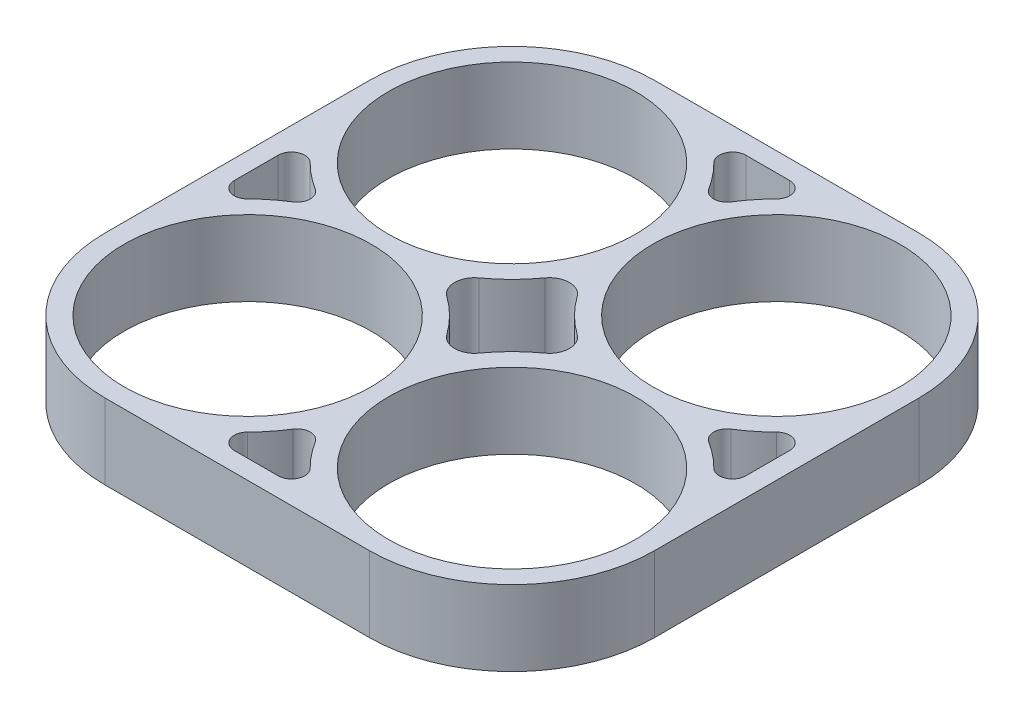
SolidWorks part; units mm, degrees
ref_plane "Ebene vorne" through (0, 0, 0) normal (0, 0, 1) x (1, 0, 0)
ref_plane "Ebene oben" through (0, 0, 0) normal (0, 1, 0) x (1, 0, 0)
ref_plane "Ebene rechts" through (0, 0, 0) normal (1, 0, 0) x (0, 0, -1)
sketch "Skizze1" plane through (0, 0, 0) normal (0, 1, 0) x (1, 0, 0)
  line L0 (-10, 20.8) -> (10, 20.8)
  line L1 (-20.8, 10) -> (-20.8, -10)
  line L2 (-10, -20.8) -> (10, -20.8)
  line L3 (20.8, -10) -> (20.8, 10)
  line L4 (0, -50) -> (0, 50) construction
  line L5 (-50, 0) -> (50, 0) construction
  line L6 (-19.35, 1.6623) -> (-19.35, -1.6623)
  line L7 (-1.6623, -19.35) -> (1.6623, -19.35)
  line L8 (-1.6623, 19.35) -> (1.6623, 19.35)
  line L9 (19.35, 1.6623) -> (19.35, -1.6623)
  circle A0 centre (-10, 10) radius 9.35
  circle A1 centre (10, 10) radius 9.35
  circle A2 centre (-10, -10) radius 9.35
  circle A3 centre (10, -10) radius 9.35
  arc A4 (-0.8475, 15.7333) -> (-2.3689, 17.6424) centre (-10, 10) ccw
  arc A5 (1.2195, 3.7117) -> (3.7117, 1.2195) centre (10, 10) ccw
  arc A6 (0.8475, -15.7333) -> (2.3689, -17.6424) centre (10, -10) ccw
  arc A7 (-1.2195, -3.7117) -> (-3.7117, -1.2195) centre (-10, -10) ccw
  arc A8 (15.7333, 0.8475) -> (17.6424, 2.3689) centre (10, 10) ccw
  arc A9 (-15.7333, -0.8475) -> (-17.6424, -2.3689) centre (-10, -10) ccw
  arc A10 (3.7117, -1.2195) -> (1.2195, -3.7117) centre (10, -10) ccw
  arc A11 (-3.7117, 1.2195) -> (-1.2195, 3.7117) centre (-10, 10) ccw
  arc A12 (-10, 20.8) -> (-20.8, 10) centre (-10, 10) ccw
  arc A13 (2.3689, 17.6424) -> (0.8475, 15.7333) centre (10, 10) ccw
  arc A14 (20.8, 10) -> (10, 20.8) centre (10, 10) ccw
  arc A15 (17.6424, -2.3689) -> (15.7333, -0.8475) centre (10, -10) ccw
  arc A16 (-20.8, -10) -> (-10, -20.8) centre (-10, -10) ccw
  arc A17 (-17.6424, 2.3689) -> (-15.7333, 0.8475) centre (-10, 10) ccw
  arc A18 (10, -20.8) -> (20.8, -10) centre (10, -10) ccw
  arc A19 (-2.3689, -17.6424) -> (-0.8475, -15.7333) centre (-10, -10) ccw
  arc A20 (-0.8475, 15.7333) -> (0.8475, 15.7333) centre (0, 16.2642) ccw
  arc A21 (2.3689, 17.6424) -> (1.6623, 19.35) centre (1.6623, 18.35) ccw
  arc A22 (-2.3689, 17.6424) -> (-1.6623, 19.35) centre (-1.6623, 18.35) cw
  arc A23 (15.7333, -0.8475) -> (15.7333, 0.8475) centre (16.2642, 0) cw
  arc A24 (17.6424, -2.3689) -> (19.35, -1.6623) centre (18.35, -1.6623) ccw
  arc A25 (19.35, 1.6623) -> (17.6424, 2.3689) centre (18.35, 1.6623) ccw
  arc A26 (-1.6623, -19.35) -> (-2.3689, -17.6424) centre (-1.6623, -18.35) cw
  arc A27 (1.6623, -19.35) -> (2.3689, -17.6424) centre (1.6623, -18.35) ccw
  arc A28 (0.8475, -15.7333) -> (-0.8475, -15.7333) centre (0, -16.2642) ccw
  arc A29 (-19.35, -1.6623) -> (-17.6424, -2.3689) centre (-18.35, -1.6623) ccw
  arc A30 (-15.7333, -0.8475) -> (-15.7333, 0.8475) centre (-16.2642, 0) ccw
  arc A31 (-17.6424, 2.3689) -> (-19.35, 1.6623) centre (-18.35, 1.6623) ccw
  arc A32 (-3.7117, -1.2195) -> (-3.7117, 1.2195) centre (-2.8383, 0) cw
  arc A33 (-1.2195, -3.7117) -> (1.2195, -3.7117) centre (0, -2.8383) ccw
  arc A34 (3.7117, -1.2195) -> (3.7117, 1.2195) centre (2.8383, 0) ccw
  arc A35 (1.2195, 3.7117) -> (-1.2195, 3.7117) centre (0, 2.8383) ccw
  point P11 (0, 0)
  point P37 (0, 0)
  point P38 (0, 0)
  point P41 (0, 14.0792)
  point P50 (19.35, -4.5947)
  point P55 (-4.5947, -19.35)
  point P60 (0, -14.0792)
  point P67 (-19.35, 4.5947)
  point P70 (-5.9208, 0)
  point P77 (0, 5.9208)
  dimension "D1" = 21.6
  dimension "D2" = 18.7
  dimension "D5" = 1
  dimension "D6" = 1.5
  dimension "D3" = 20
  dimension "D4" = 20
extrude "Aufsatz-Linear austragen1" add sketch "Skizze1" along normal blind 5.7
